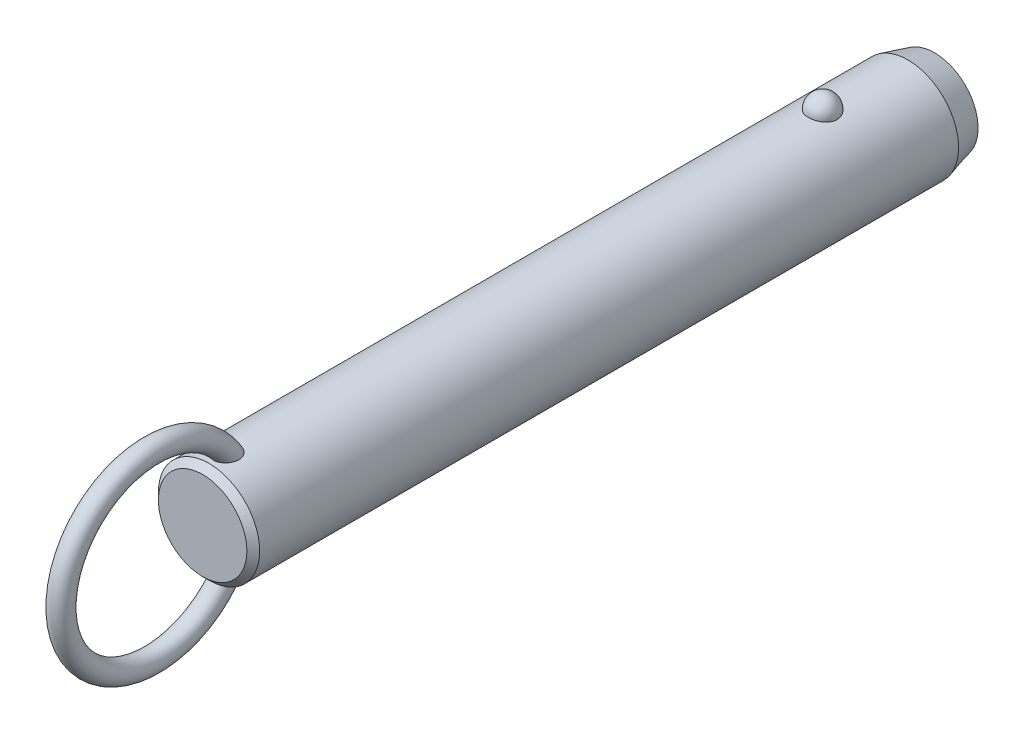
SolidWorks part; units mm, degrees
ref_plane "Front Plane" through (0, 0, 0) normal (0, 0, 1) x (1, 0, 0)
ref_plane "Top Plane" through (0, 0, 0) normal (0, 1, 0) x (1, 0, 0)
ref_plane "Right Plane" through (0, 0, 0) normal (1, 0, 0) x (0, 0, -1)
sketch "Sketch2" plane through (0, 0, 0) normal (0, 0, 1) x (1, 0, 0)
  circle A0 centre (0, 0) radius 9.5
  point P3 (0, 9.5)
  dimension "D1" = 19
extrude "Boss-Extrude1" add sketch "Sketch2" along normal blind 104.1
sketch "Sketch3" plane through (0, 0, 0) normal (0, 0, -1) x (-1, 0, 0)
  circle A0 centre (0, 0) radius 9.5
  dimension "D1" = 19
extrude "Boss-Extrude2" add sketch "Sketch3" along normal blind 23.7
chamfer "Chamfer1" distance 5 angle 15 1 edges at (-9.5, 0, -23.7)
sketch "Sketch12" plane through (0, 0, 0) normal (1, 0, 0) x (0, 0, -1)
  line L0 (-104.1, 9.5) -> (-104.1, -9.5) construction
  point P0 (-104.1, 0)
sketch "Sketch13" plane through (0, 0, 0) normal (1, 0, 0) x (0, 0, -1)
  circle A0 centre (-123.15, 0) radius 19.05
  point P2 (-104.1, 0)
  dimension "D1" = 38.1
sketch "Sketch14" plane through (0, 0, 0) normal (0, 1, 0) x (1, 0, 0)
  circle A0 centre (0, -106.1) radius 2
  point P2 (0, -104.1)
  dimension "D1" = 4
sweep "Sweep1" add profiles "Sketch14" path "Sketch13"
sketch "Sketch15" plane through (0, 0, 104.1) normal (0, 0, 1) x (1, 0, 0)
  circle A0 centre (0, 0) radius 9.5
  dimension "D1" = 19
extrude "Boss-Extrude3" add sketch "Sketch15" along normal blind 9.52
chamfer "Chamfer2" distance 1.2 angle 45 1 edges at (9.5, 0, 113.62)
sketch "Sketch18" plane through (0, 0, 0) normal (1, 0, 0) x (0, 0, -1)
  line L0 (18.7, 9.5) -> (-106.6378, 9.5) construction
  line L1 (2.7, 12.2) -> (2.7, 6.8)
  line L2 (-106.6378, -9.5) -> (18.7, -9.5) construction
  arc A0 (2.7, 12.2) -> (2.7, 6.8) centre (2.7, 9.5) ccw
  point P4 (0, 9.5)
  dimension "D1" = 21.7
revolve "Revolve1" add sketch "Sketch18" angle 360 about L1
